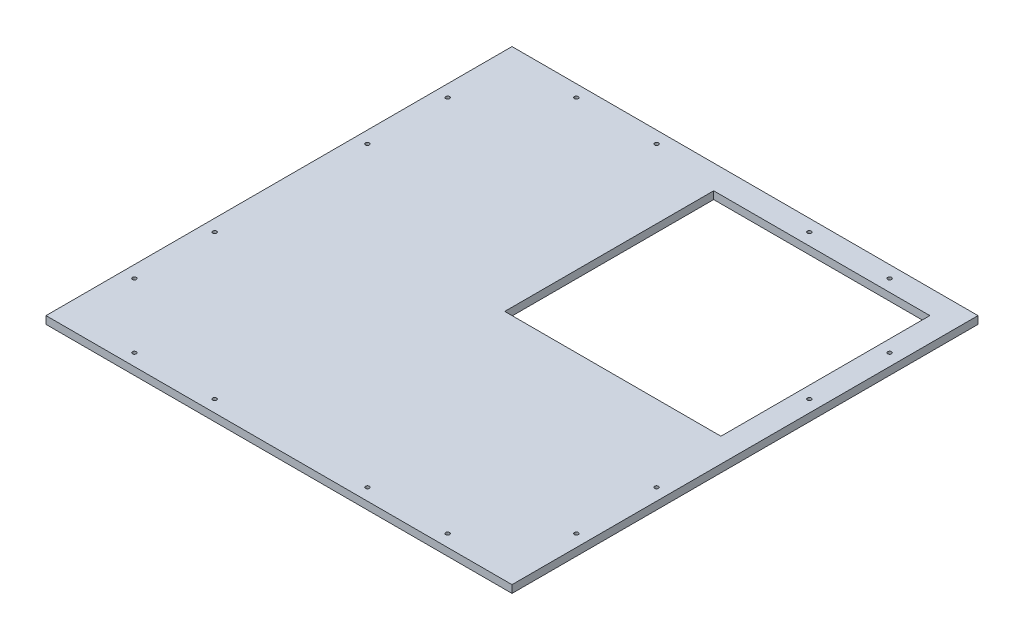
SolidWorks part; units mm, degrees
ref_plane "Front Plane" through (0, 0, 0) normal (0, 0, 1) x (1, 0, 0)
ref_plane "Top Plane" through (0, 0, 0) normal (0, 1, 0) x (1, 0, 0)
ref_plane "Right Plane" through (0, 0, 0) normal (1, 0, 0) x (0, 0, -1)
sketch "Sketch1" plane through (0, 0, 0) normal (0, 1, 0) x (1, 0, 0)
  line L1 (0, 0) -> (1220, 0)
  line L2 (0, 0) -> (0, 1220)
  line L3 (0, 1220) -> (1220, 1220)
  line L4 (1220, 0) -> (1220, 1220)
  dimension "D1" = 1220
  dimension "D2" = 1220
extrude "Boss-Extrude1" add sketch "Sketch1" along normal blind 20
sketch "Sketch2" plane through (0, 20, 0) normal (0, 1, 0) x (1, 0, 0)
  line L0 (610, 1220) -> (610, 0) construction
  line L1 (591, 1157) -> (1157, 1157)
  line L2 (591, 1157) -> (591, 610)
  line L3 (591, 610) -> (1157, 610)
  line L4 (1157, 1157) -> (1157, 610)
  line L5 (1220, 1220) -> (0, 1220) construction
  line L6 (0, 0) -> (1220, 0) construction
  line L7 (0, 610) -> (1220, 610) construction
  line L8 (0, 1220) -> (0, 0) construction
  line L9 (1220, 0) -> (1220, 1220) construction
  dimension "D1" = 63
  dimension "D2" = 63
  dimension "D3" = 19
extrude "Cut-Extrude1" cut sketch "Sketch2" against normal blind 20
sketch "Sketch3" plane through (0, 20, 0) normal (0, 1, 0) x (1, 0, 0)
  circle A0 centre (410, 1188.5) radius 5 construction
  circle A1 centre (200, 1188.5) radius 5 construction
  circle A2 centre (31.5, 1020) radius 5 construction
  circle A3 centre (31.5, 810) radius 5 construction
  circle A4 centre (31.5, 410) radius 5 construction
  circle A5 centre (31.5, 200) radius 5 construction
  circle A6 centre (200, 31.5) radius 5 construction
  circle A7 centre (410, 1188.5) radius 5
  circle A8 centre (200, 1188.5) radius 5
  circle A9 centre (31.5, 1020) radius 5
  circle A10 centre (31.5, 810) radius 5
  circle A11 centre (31.5, 410) radius 5
  circle A12 centre (31.5, 200) radius 5
  circle A13 centre (200, 31.5) radius 5
  circle A14 centre (410, 31.5) radius 5 construction
  circle A15 centre (810, 31.5) radius 5 construction
  circle A16 centre (1020, 31.5) radius 5 construction
  circle A17 centre (1188.5, 410) radius 5 construction
  circle A18 centre (1188.5, 200) radius 5 construction
  circle A19 centre (1188.5, 810) radius 5 construction
  circle A20 centre (1188.5, 1020) radius 5 construction
  circle A21 centre (1020, 1188.5) radius 5 construction
  circle A22 centre (810, 1188.5) radius 5 construction
  circle A23 centre (410, 31.5) radius 5
  circle A24 centre (810, 31.5) radius 5
  circle A25 centre (1020, 31.5) radius 5
  circle A26 centre (1188.5, 410) radius 5
  circle A27 centre (1188.5, 200) radius 5
  circle A28 centre (1188.5, 810) radius 5
  circle A29 centre (1188.5, 1020) radius 5
  circle A30 centre (1020, 1188.5) radius 5
  circle A31 centre (810, 1188.5) radius 5
extrude "Cut-Extrude2" cut sketch "Sketch3" against normal up to next
